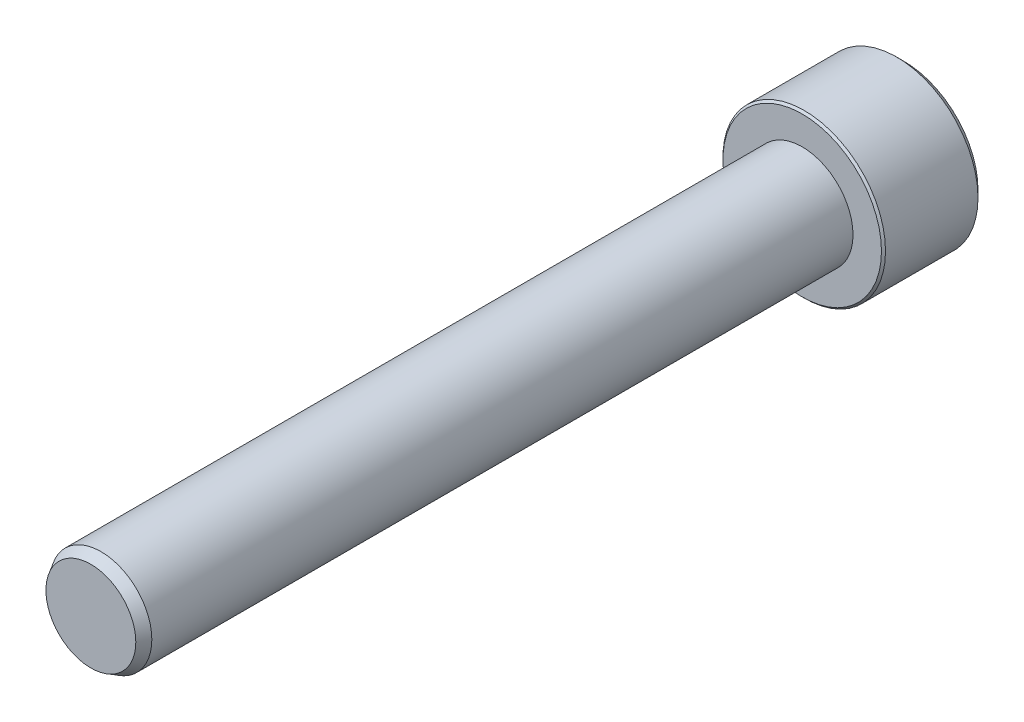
SolidWorks part; units mm, degrees
ref_plane "Plan1" through (0, 0, 0) normal (0, 0, 1) x (1, 0, 0)
ref_plane "Plan2" through (0, 0, 0) normal (0, 1, 0) x (1, 0, 0)
ref_plane "Plan3" through (0, 0, 0) normal (1, 0, 0) x (0, 0, -1)
sketch "Esquisse1" plane through (0, 0, 0) normal (0, 0, 1) x (1, 0, 0)
  circle A0 centre (0, 0) radius 5
  dimension "D1" = 10
extrude "Base-Extrusion" add sketch "Esquisse1" along normal blind 70
sketch "Esquisse2" plane through (0, 0, 0) normal (0, 0, 1) x (1, 0, 0)
  circle A0 centre (0, 0) radius 8
  dimension "D1" = 16
extrude "Boss.-Extru.1" add sketch "Esquisse2" against normal blind 10
ref_plane "Plan4" through (0, 0, -10) normal (0, 0, 1) x (1, 0, 0)
sketch "Esquisse3" plane through (0, 0, -10) normal (0, 0, 1) x (1, 0, 0)
  line L0 (-2.3094, 4) -> (2.3094, 4)
  line L1 (-2.3094, -4) -> (2.3094, -4)
  line L2 (-2.3094, 4) -> (-4.6188, 0)
  line L3 (2.3094, -4) -> (4.6188, 0)
  line L4 (-4.6188, 0) -> (-2.3094, -4)
  line L6 (2.3094, 4) -> (4.6188, 0)
  dimension "D3" = 4
  dimension "D1" = 4
  dimension "D2" = 8
  dimension "D4" = 8
  dimension "D5" = 4
  dimension "D6" = 8
extrude "Enlèv. mat.-Extru.1" cut sketch "Esquisse3" along normal blind 5.5
chamfer "Chanfrein1" distance 0.7 angle 45 1 edges at (8, 0, -10)
chamfer "Chanfrein2" distance 1 angle 30 1 edges at (5, 0, 70)
chamfer "Chanfrein3" distance 0.2 angle 45 1 edges at (8, 0, 0)
